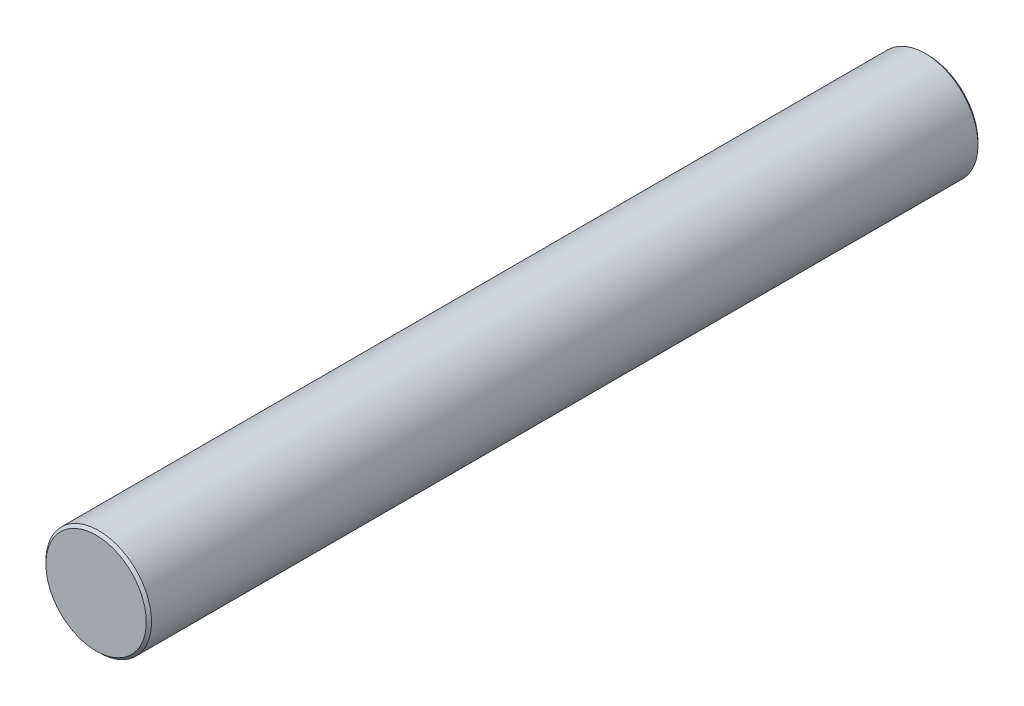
SolidWorks part; units mm, degrees
ref_plane "前视基准面" through (0, 0, 0) normal (0, 0, 1) x (1, 0, 0)
ref_plane "上视基准面" through (0, 0, 0) normal (0, 1, 0) x (1, 0, 0)
ref_plane "右视基准面" through (0, 0, 0) normal (1, 0, 0) x (0, 0, -1)
sketch "草图1" plane through (0, 0, 0) normal (0, 0, 1) x (1, 0, 0)
  circle A0 centre (0, 0) radius 40
extrude "凸台-拉伸1" add sketch "草图1" along normal blind 630
hole_wizard "M16 螺纹孔1" positions "草图2" profile "草图3" tap size "M16" standard "ISO"
sketch "草图2" plane through (0, 0, 0) normal (0, 0, -1) x (-1, 0, 0)
  point P0 (0, 0)
sketch "草图3" plane through (0, 0, 0) normal (1, 0, 0) x (0, 1, 0)
  line L0 (0, 0) -> (0, 42.206)
  line L1 (0, 42.206) -> (7, 38)
  line L2 (7, 38) -> (7, 0)
  line L5 (7, 0) -> (0, 0)
  line L10 (0, 42.206) -> (-7, 38) construction
  line L11 (0, -6.35) -> (0, 107.95) construction
  dimension "螺纹孔钻头直径" = 14
  dimension "螺纹孔钻头深度" = 38
  dimension "导头角度" = 118
chamfer "倒角1" distance 2 angle 45 2 edges at (40, 0, 630) (40, 0, 0)
